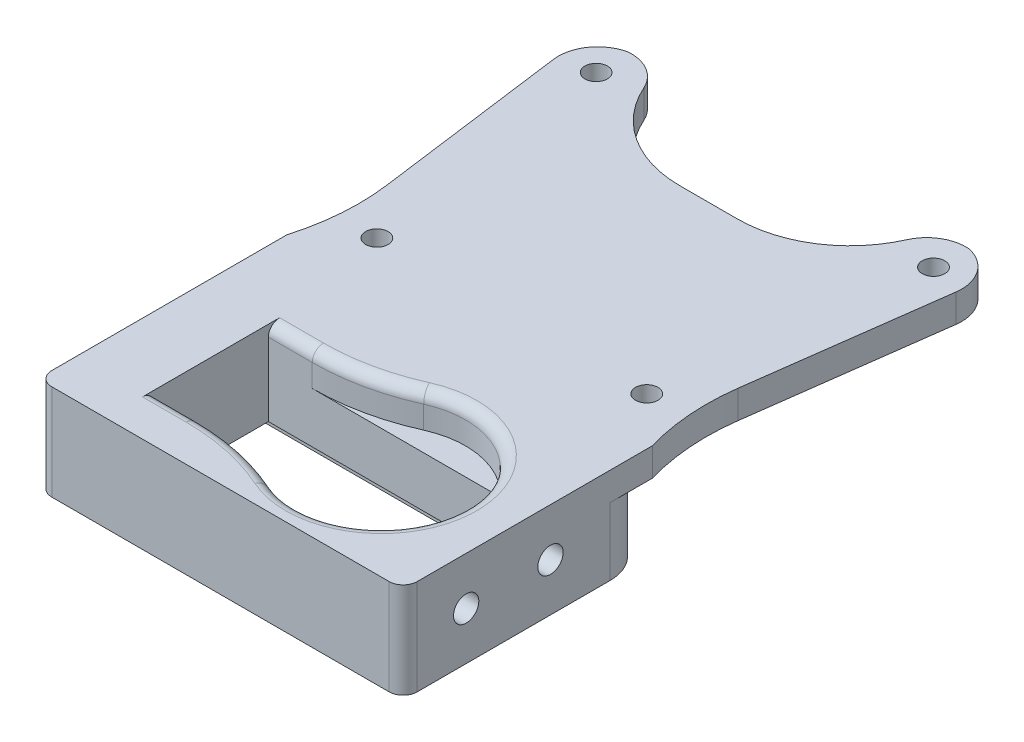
SolidWorks part; units mm, degrees
ref_plane "Front Plane" through (0, 0, 0) normal (0, 0, 1) x (1, 0, 0)
ref_plane "Top Plane" through (0, 0, 0) normal (0, 1, 0) x (1, 0, 0)
ref_plane "Right Plane" through (0, 0, 0) normal (1, 0, 0) x (0, 0, -1)
sketch "Sketch1" plane through (0, 0, 0) normal (0, 1, 0) x (1, 0, 0)
  line L0 (0, -22.5) -> (0, 22.5) construction
  line L1 (0, 22.5) -> (-30, 22.5) construction
  line L2 (22.6136, 12.5) -> (-22.6136, 12.5)
  line L3 (-24, -22.5) -> (0, -22.5) construction
  line L4 (-22.6136, 12.5) -> (-24.8456, 29.2403)
  line L5 (-24.8456, 29.2403) -> (-36.7403, 27.6544)
  line L6 (-36.7403, 27.6544) -> (-28.7198, -32.5)
  line L8 (-28.7198, -32.5) -> (-28.7198, -62.5)
  line L9 (-28.7198, -62.5) -> (28.7198, -62.5)
  line L10 (28.7198, -32.5) -> (28.7198, -62.5)
  line L12 (24.8456, 29.2403) -> (36.7403, 27.6544)
  line L13 (22.6136, 12.5) -> (24.8456, 29.2403)
  line L14 (36.7403, 27.6544) -> (28.7198, -32.5)
  line L15 (-30, 22.5) -> (-24, -22.5) construction
  line L16 (-24.0526, 23.293) -> (-35.9474, 21.707) construction
  line L17 (-30, 22.5) -> (-30.793, 28.4474) construction
  line L18 (-18.0526, -21.707) -> (-29.9474, -23.293) construction
  line L19 (0, -47.5) -> (10.1, -47.5) construction
  line L20 (-27.2, -57.55) -> (27.2, -57.55) construction
  line L21 (-27.2, -57.55) -> (-27.2, -37.45) construction
  line L22 (-27.2, -37.45) -> (27.2, -37.45) construction
  line L23 (27.2, -57.55) -> (27.2, -37.45) construction
  line L24 (-27.2, -57.55) -> (27.2, -37.45) construction
  line L25 (-27.2, -37.45) -> (27.2, -57.55) construction
  line L26 (-28.7198, -47.5) -> (0, -47.5) construction
  line L27 (0, -47.5) -> (0, -62.5) construction
  circle A0 centre (-30, 22.5) radius 2
  circle A1 centre (-24, -22.5) radius 2
  circle A2 centre (24, -22.5) radius 2
  circle A3 centre (30, 22.5) radius 2
  circle A4 centre (24, -22.5) radius 20 construction
  circle A5 centre (10.1, -47.5) radius 10 construction
  point P4 (0, 0)
  point P12 (0, -47.5)
  point P21 (-30, 22.5)
  point P24 (0, -62.5)
  point P29 (0, 12.5)
  point P33 (-24, -22.5)
  dimension "D1" = 45
  dimension "D4" = 4
  dimension "D10" = 40
  dimension "D14" = 20
  dimension "D2" = 24
  dimension "D3" = 30
  dimension "D5" = 20
  dimension "D6" = 12
  dimension "D7" = 6
  dimension "D8" = 30
  dimension "D9" = 10
  dimension "D11" = 54.4
  dimension "D12" = 20.1
  dimension "D13" = 10.1
extrude "Boss-Extrude1" add sketch "Sketch1" along normal blind 5
fillet "Fillet1" radius 20 2 edges at (22.6136, 2.5, -12.5) (-22.6136, 2.5, -12.5)
fillet "Fillet2" radius 7 6 edges at (36.7403, 2.5, -27.6544) (-36.7403, 2.5, -27.6544) (28.7198, 2.5, 32.5) (-28.7198, 2.5, 32.5) (24.8456, 2.5, -29.2403) (-24.8456, 2.5, -29.2403)
sketch "Sketch3" plane through (0, 5, 0) normal (0, 1, 0) x (1, 0, 0)
  line L0 (-24, -22.5) -> (24, -22.5) construction
  line L1 (0, -22.5) -> (0, -30) construction
  line L2 (32.5, -30) -> (-32.5, -30)
  line L3 (0, -30) -> (0, -55.6222) construction
  line L4 (0, -55.6222) -> (9.896, -55.6222) construction
  line L5 (-27.15, -65.8222) -> (27.15, -65.8222) construction
  line L6 (-27.15, -65.8222) -> (-27.15, -45.4222) construction
  line L7 (-27.15, -45.4222) -> (27.15, -45.4222) construction
  line L8 (27.15, -65.8222) -> (27.15, -45.4222) construction
  line L9 (-27.15, -65.8222) -> (27.15, -45.4222) construction
  line L10 (-27.15, -45.4222) -> (27.15, -65.8222) construction
  line L11 (-32.5, -30) -> (-32.5, -74.3222)
  line L12 (-32.5, -74.3222) -> (32.5, -74.3222)
  line L13 (32.5, -74.3222) -> (32.5, -30)
  line L14 (9.896, -55.6222) -> (24, -22.5) construction
  circle A0 centre (24, -22.5) radius 25 construction
  circle A1 centre (-24, -22.5) radius 25 construction
  circle A2 centre (24, -22.5) radius 22.75 construction
  circle A3 centre (9.896, -55.6222) radius 13 construction
  circle A4 centre (9.896, -55.6222) radius 10.75 construction
  point P7 (0, -47.5)
  point P10 (0, -30)
  dimension "D3" = 50
  dimension "D4" = 45.5
  dimension "D8" = 26
  dimension "D9" = 21.5
  dimension "D1" = 7.5
  dimension "D2" = 65
  dimension "D5" = 54.3
  dimension "D6" = 20.4
  dimension "D7" = 9.896
  dimension "D10" = 36
  dimension "D11" = 8.5
  dimension "D12" = 36
extrude "Boss-Extrude2" add sketch "Sketch3" against normal blind 17
sketch "Sketch5" plane through (0, 5, 0) normal (0, 1, 0) x (1, 0, 0)
  line L0 (-27.15, -45.4222) -> (27.15, -65.8222) construction
  line L1 (20.375, -65.8222) -> (-20.375, -65.8222)
  line L2 (20.375, -65.8222) -> (20.375, -45.4222)
  line L3 (20.375, -45.4222) -> (-20.375, -45.4222)
  line L4 (-20.375, -65.8222) -> (-20.375, -45.4222)
  line L5 (20.375, -65.8222) -> (-20.375, -45.4222) construction
  line L6 (20.375, -45.4222) -> (-20.375, -65.8222) construction
  line L7 (-27.15, -45.4222) -> (27.15, -45.4222) construction
  point P0 (0, -55.6222)
  dimension "D1" = 40.75
extrude "Cut-Extrude1" cut sketch "Sketch5" against normal through all
sketch "Sketch6" plane through (0, -12, 0) normal (0, -1, 0) x (1, 0, 0)
  line L0 (0, 55.6222) -> (-24.4042, 55.6222) construction
  line L1 (-24.4042, 55.6222) -> (-24.4042, 60.6222) construction
  line L2 (0, 55.6222) -> (0, 42.8111) construction
  line L3 (0, 30) -> (0, 55.6222) construction
  circle A0 centre (-24.4042, 60.6222) radius 2.25
  circle A1 centre (-24.4042, 50.6222) radius 2.25
  circle A2 centre (24.4042, 60.6222) radius 2.25
  circle A3 centre (24.4042, 50.6222) radius 2.25
  dimension "D3" = 4.5
  dimension "D1" = 24.4042
  dimension "D2" = 5
extrude "Cut-Extrude2" cut sketch "Sketch6" against normal blind 5
sketch "Sketch7" plane through (0, -12, 0) normal (0, -1, 0) x (1, 0, 0)
  line L0 (27.15, 65.8222) -> (27.15, 45.4222) construction
  line L1 (-27.15, 45.4222) -> (27.15, 45.4222) construction
  line L2 (-27.15, 65.8222) -> (-27.15, 45.4222) construction
  line L3 (-27.15, 65.8222) -> (27.15, 65.8222) construction
  line L4 (28.65, 67.3222) -> (28.65, 43.9222)
  line L5 (-28.65, 43.9222) -> (28.65, 43.9222)
  line L6 (-28.65, 67.3222) -> (-28.65, 43.9222)
  line L7 (-28.65, 67.3222) -> (28.65, 67.3222)
  line L8 (27.15, 65.8222) -> (27.15, 45.4222) construction
  line L9 (-27.15, 45.4222) -> (27.15, 45.4222) construction
  line L10 (-27.15, 65.8222) -> (-27.15, 45.4222) construction
  line L11 (-27.15, 65.8222) -> (27.15, 65.8222) construction
  dimension "D1" = 1.5
extrude "Cut-Extrude3" cut sketch "Sketch7" against normal blind 2
sketch "Sketch8" plane through (0, 5, 0) normal (0, 1, 0) x (1, 0, 0)
  circle A0 centre (9.896, -55.6222) radius 15
  dimension "D1" = 30
extrude "Cut-Extrude4" cut sketch "Sketch8" against normal blind 6
fillet "Fillet4" radius 40 2 edges at (29.0531, 2.5, 30) (-29.0531, 2.5, 30)
fillet "Fillet5" radius 40 2 edges at (-1.1022, 2, 65.8222) (-1.1022, 2, 45.4222)
sketch "Sketch9" plane through (0, 0, 0) normal (0, -1, 0) x (1, 0, 0)
  line L0 (0, 30) -> (0, 0) construction
  line L1 (32.5, 30) -> (-32.5, 30) construction
  line L2 (12.5, -5) -> (-12.5, -5)
  line L3 (12.5, 12.5) -> (12.5, 30)
  line L4 (12.5, 30) -> (-12.5, 30)
  line L5 (-12.5, 12.5) -> (-12.5, 30)
  line L6 (12.5, -5) -> (-12.5, 30) construction
  line L7 (12.5, 30) -> (-12.5, -5) construction
  line L8 (-12.5, 12.5) -> (-25.5, -5)
  line L9 (-25.5, -5) -> (-12.5, -5)
  line L10 (-12.5, 12.5) -> (12.5, 12.5) construction
  line L11 (-12.5, 12.5) -> (-12.5, -5) construction
  line L12 (12.5, 12.5) -> (12.5, -5) construction
  line L13 (25.5, -5) -> (12.5, -5)
  line L14 (12.5, 12.5) -> (25.5, -5)
  point P4 (0, 12.5)
  dimension "D1" = 25
  dimension "D2" = 35
  dimension "D3" = 13
extrude "Boss-Extrude3" add sketch "Sketch9" along normal up to surface (12 mm away)
chamfer "Chamfer1" distance 20 angle 30 1 edges at (0, -12, -5)
fillet "Fillet6" radius 40 1 edges at (0, -12, 15)
fillet "Fillet7" radius 10 2 edges at (-12.5, -6, 30) (12.5, -6, 30)
sketch "Sketch10" plane through (0, -10, 0) normal (0, -1, 0) x (1, 0, 0)
  line L0 (0, 55.6222) -> (28.65, 55.6222) construction
  line L1 (28.65, 43.9222) -> (28.65, 67.3222) construction
  line L2 (20.375, 54.8722) -> (20.375, 56.3722)
  line L3 (20.375, 45.4222) -> (20.375, 65.8222) construction
  line L4 (20.375, 56.3722) -> (28.65, 56.3722)
  line L5 (28.65, 43.9222) -> (28.65, 67.3222) construction
  line L6 (28.65, 56.3722) -> (28.65, 54.8722)
  line L7 (28.65, 54.8722) -> (20.375, 54.8722)
  line L8 (0, 55.6222) -> (0, 45.4222) construction
  line L9 (-27.15, 45.4222) -> (27.15, 45.4222) construction
  line L10 (-28.65, 54.8722) -> (-20.375, 54.8722)
  line L11 (-28.65, 56.3722) -> (-28.65, 54.8722)
  line L12 (-20.375, 56.3722) -> (-28.65, 56.3722)
  line L13 (-20.375, 54.8722) -> (-20.375, 56.3722)
  point P10 (20.375, 55.6222)
  point P21 (-20.375, 55.6222)
  dimension "D1" = 1.5
extrude "Cut-Extrude5" cut sketch "Sketch10" against normal blind 2
fillet "Fillet8" radius 1 4 edges at (24.5125, -10, 54.8722) (24.5125, -10, 56.3722) (-24.5125, -10, 54.8722) (-24.5125, -10, 56.3722)
fillet "Fillet9" radius 2 5 edges at (-16.4752, 5, 45.4222) (-16.4752, 5, 65.8222) (-4.2196, 5, 66.7046) (24.896, 5, 55.6222) (-4.2196, 5, 44.5397)
sketch "Sketch11" plane through (-32.5, 0, 0) normal (-1, 0, 0) x (0, 0, 1)
  line L0 (74.3222, -3.5) -> (30, -3.5) construction
  line L1 (74.3222, -12) -> (74.3222, 5) construction
  line L2 (30, 0) -> (30, -12) construction
  line L3 (55.6222, 5) -> (55.6222, -12) construction
  line L4 (30, 5) -> (74.3222, 5) construction
  line L5 (30, -12) -> (74.3222, -12) construction
  line L6 (43.4222, 5) -> (67.8222, 5) construction
  line L7 (43.4222, 5) -> (67.8222, 5) construction
  circle A0 centre (48.1222, -3.5) radius 2.25
  circle A2 centre (63.1222, -3.5) radius 2.25
  dimension "D1" = 4.5
  dimension "D2" = 15
extrude "Cut-Extrude6" cut sketch "Sketch11" against normal blind 5
ref_plane "Plane1" through (0, 0, 0) normal (1, 0, 0) x (0, 0, -1)
mirror "Mirror1" about plane through (0, 0, 0) normal (1, 0, 0) of "Cut-Extrude6"
fillet "Fillet10" radius 2.5 2 edges at (32.5, -3.5, 74.3222) (-32.5, -3.5, 74.3222)
fillet "Fillet11" radius 7.5 2 edges at (-32.5, -6, 30) (32.5, -6, 30)
sketch "Sketch13" plane through (-32.5, 0, 0) normal (-1, 0, 0) x (0, 0, 1)
  line L0 (48.1222, -3.5) -> (63.1222, -3.5) construction
  line L1 (63.1222, -3.5) -> (74.3222, -3.5) construction
  line L2 (74.3222, 5) -> (74.3222, -12) construction
  dimension "D1" = 15
  dimension "D2" = 26.2
fillet "Fillet12" radius 30 2 edges at (12.5, -4.8765, 12.5) (-12.5, -4.8765, 12.5)
